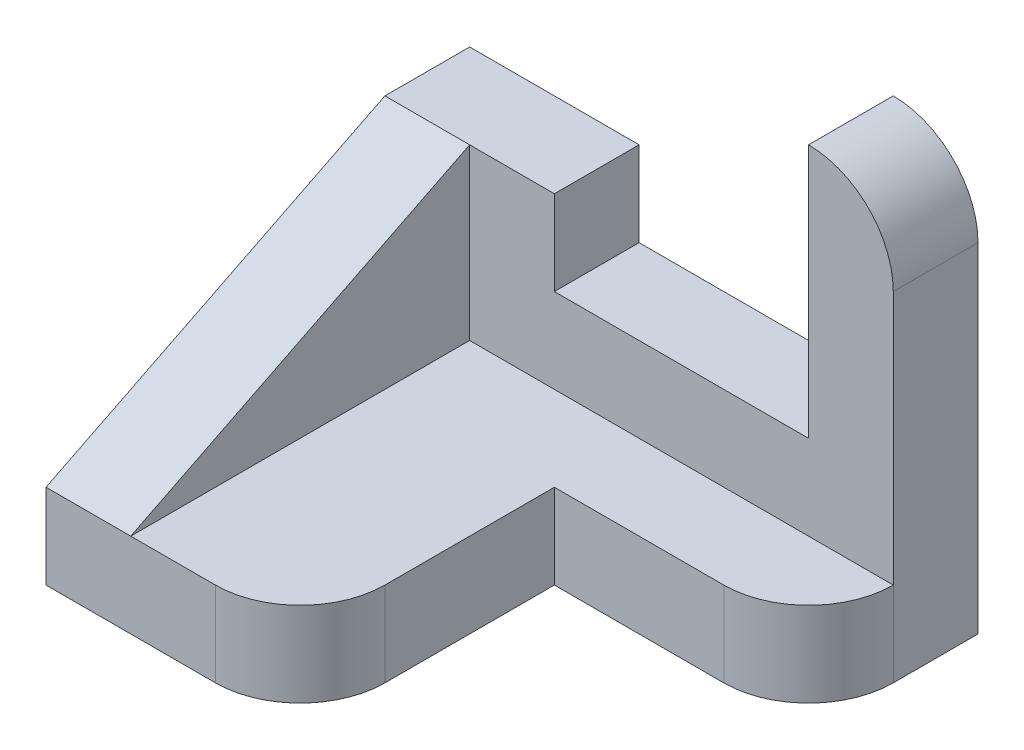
SolidWorks part; units mm, degrees
ref_plane "Front Plane" through (0, 0, 0) normal (0, 0, 1) x (1, 0, 0)
ref_plane "Top Plane" through (0, 0, 0) normal (0, 1, 0) x (1, 0, 0)
ref_plane "Right Plane" through (0, 0, 0) normal (1, 0, 0) x (0, 0, -1)
sketch "Sketch1" plane through (0, 0, 0) normal (0, 1, 0) x (1, 0, 0)
  line L0 (0, 0) -> (60, 0)
  line L1 (60, 0) -> (60, -20)
  line L2 (60, -20) -> (30, -20)
  line L3 (30, -20) -> (30, -50)
  line L4 (30, -50) -> (0, -50)
  line L5 (0, -50) -> (0, 0)
  dimension "D1" = 30
  dimension "D2" = 20
  dimension "D3" = 50
  dimension "D4" = 60
extrude "Extrude1" add sketch "Sketch1" along normal blind 10
sketch "Sketch2" plane through (0, 0, 0) normal (0, 0, 1) x (1, 0, 0)
  line L0 (0, 10) -> (0, 30)
  line L1 (0, 30) -> (20, 30)
  line L2 (20, 30) -> (20, 20)
  line L3 (20, 20) -> (50, 20)
  line L4 (50, 20) -> (50, 50)
  line L5 (50, 50) -> (60, 50)
  line L6 (60, 50) -> (60, 10)
  line L7 (60, 10) -> (0, 10)
  dimension "D1" = 10
  dimension "D2" = 30
  dimension "D3" = 20
  dimension "D4" = 10
  dimension "D5" = 20
extrude "Extrude2" add sketch "Sketch2" along normal blind 10 contours L7 L6 L5 L4 L3 L2 L1 L0
sketch "Sketch3" plane through (0, 0, 0) normal (-1, 0, 0) x (0, 0, 1)
  line L0 (10, 30) -> (50, 10)
rib "Rib1" sketch "Sketch3" sketch "Sketch3" thickness 10 extrusion direction parallel to sketch draft on no parameters "D1"=10
fillet "Fillet1" radius 10 3 edges at (60, 5, 20) (30, 5, 50) (60, 50, 5)
